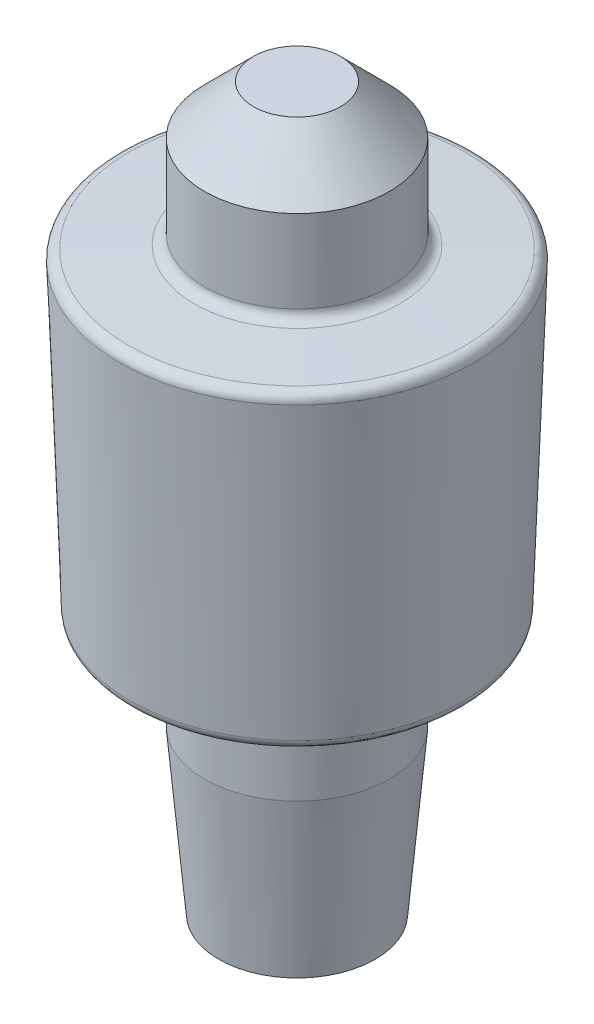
SolidWorks part; units mm, degrees
ref_plane "Plan de face" through (0, 0, 0) normal (0, 0, 1) x (1, 0, 0)
ref_plane "Plan de dessus" through (0, 0, 0) normal (0, 1, 0) x (1, 0, 0)
ref_plane "Plan de droite" through (0, 0, 0) normal (1, 0, 0) x (0, 0, -1)
surface "Surface-Cousue1"
surface "Surface-Plan1"
surface "Surface-Cousue2"
ref_plane "Plan4" through (0, 70.1342, 0) normal (0, 1, 0) x (-1, 0, 0)
sketch "Esquisse1" plane through (0, 70.1342, 0) normal (0, 1, 0) x (-1, 0, 0)
  circle A0 centre (13.7594, 0) radius 28.3401 construction
  circle A1 centre (13.7594, 0) radius 28.3401
extrude "Extrusion1" add sketch "Esquisse1" along normal blind 15 draft 45
ref_plane "Plan5" through (0, -85.7363, 0) normal (0, -1, 0) x (1, 0, 0)
sketch "Esquisse2" plane through (0, -85.7363, 0) normal (0, -1, 0) x (1, 0, 0)
  circle A0 centre (-13.7594, 0) radius 28.3401 construction
  circle A1 centre (-13.7594, 0) radius 28.3401
extrude "Extrusion2" add sketch "Esquisse2" along normal blind 50 draft 5
sketch "Esquisse3" plane through (0, 0, 0) normal (0, 0, 1) x (1, 0, 0)
  line L0 (-45.1359, 41.7941) -> (-72.9337, 40.3373)
  line L4 (-72.9337, 40.3373) -> (-72.9337, 41.7941)
  line L5 (-72.9337, 41.7941) -> (-45.1359, 41.7941)
  dimension "D1" = 3
revolve "Enlèvement de matière-Révolution1" cut sketch "Esquisse3" angle 360 about axis through (-13.7594, 70.1342, 0) along (0, -1, 0)
fillet "Congé1" radius 3 1 edges at (-67.4075, 40.6269, 0)
sketch "Esquisse4" plane through (0, 0, 0) normal (0, 0, 1) x (1, 0, 0)
  line L0 (-45.1359, -57.3962) -> (-64.731, -56.3692)
  line L1 (-68.014, 37.6434) -> (-64.7975, -54.4657) construction
  line L2 (-64.731, -56.3692) -> (-64.731, -57.3962)
  line L3 (-64.731, -57.3962) -> (-45.1359, -57.3962)
  dimension "D1" = 3
revolve "Enlèvement de matière-Révolution2" cut sketch "Esquisse4" angle 360 about axis through (-13.7594, -57.3962, 0) along (0, -1, 0)
fillet "Congé2" radius 3 1 edges at (36.4863, -56.4073, 0)
